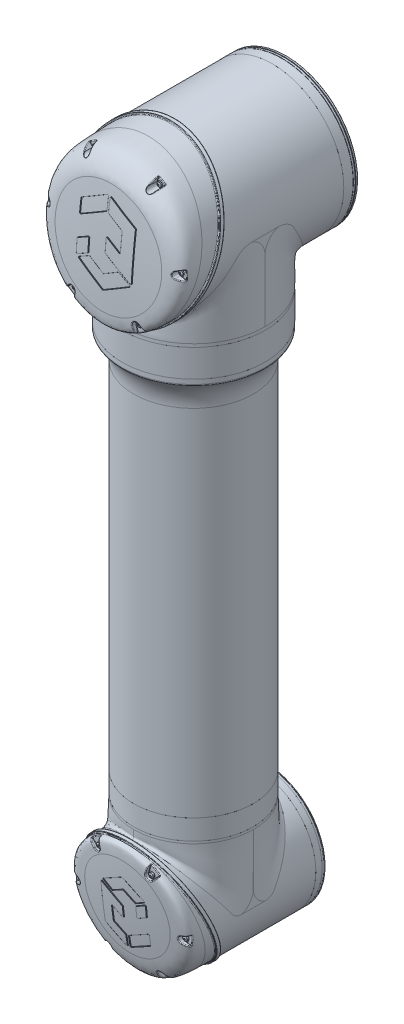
SolidWorks part; units mm, degrees
ref_plane "前视基准面" through (0, 0, 0) normal (0, 0, 1) x (1, 0, 0)
ref_plane "上视基准面" through (0, 0, 0) normal (0, 1, 0) x (1, 0, 0)
ref_plane "右视基准面" through (0, 0, 0) normal (1, 0, 0) x (0, 0, -1)
imported_body "40关节-C-1-solid1"
imported_body "40关节-C-1-solid2"
imported_body "40关节-C-1-surface1"
imported_body "C25上臂组件-1-solid1"
imported_body "C25上臂组件-1-solid2"
imported_body "C25上臂组件-1-solid3"
imported_body "C25上臂组件-1-solid4"
imported_body "C25上臂组件-1-solid5"
imported_body "32-1-solid1"
imported_body "32-1-solid2"
imported_body "32-1-solid3"
imported_body "32-1-solid4"
imported_body "32-1-solid5"
imported_body "32-1-solid6"
imported_body "32-1-solid7"
imported_body "32-1-solid8"
imported_body "32-1-solid9"
imported_body "32-1-solid10"
imported_body "32-1-solid11"
imported_body "32-1-solid12"
imported_body "32-1-solid13"
imported_body "32-1-solid14"
imported_body "32-1-solid15"
imported_body "32-1-solid16"
delete or keep bodies "实体-删除/保留 1" type delete bodies bodies 108
